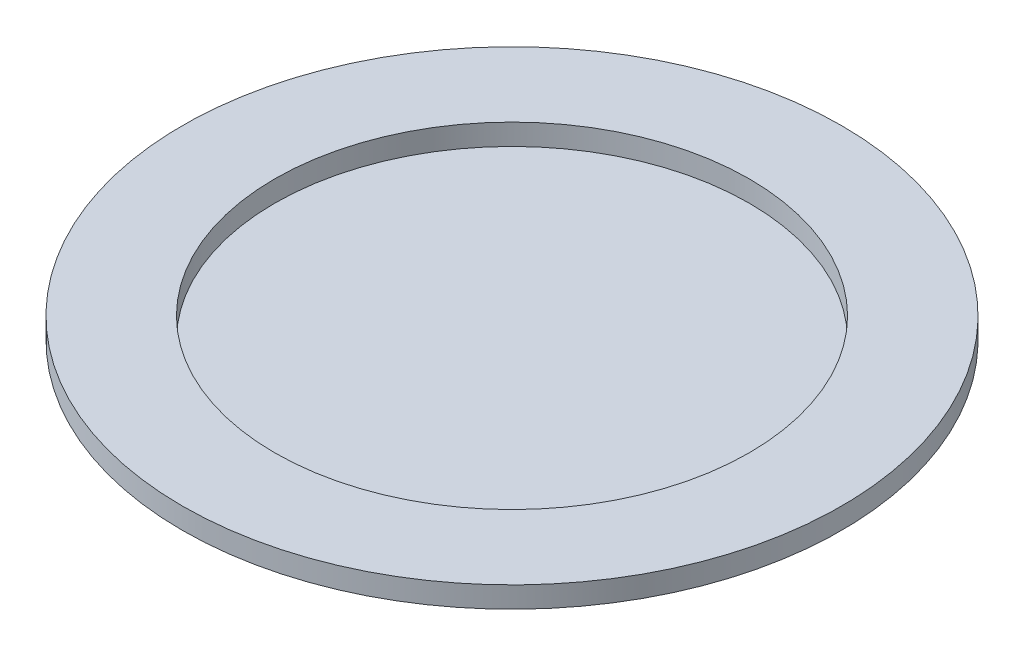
SolidWorks part; units mm, degrees
ref_plane "Front Plane" through (0, 0, 0) normal (0, 0, 1) x (1, 0, 0)
ref_plane "Top Plane" through (0, 0, 0) normal (0, 1, 0) x (1, 0, 0)
ref_plane "Right Plane" through (0, 0, 0) normal (1, 0, 0) x (0, 0, -1)
sketch "Sketch1" plane through (0, 0, 0) normal (0, 1, 0) x (1, 0, 0)
  circle A0 centre (0, 0) radius 50
extrude "Boss-Extrude1" add sketch "Sketch1" along normal blind 4
sketch "Sketch2" plane through (0, 4, 0) normal (0, 1, 0) x (1, 0, 0)
  circle A0 centre (0, 0) radius 62.5
  circle A1 centre (0, 0) radius 45
extrude "Boss-Extrude2" add sketch "Sketch2" along normal blind 4
